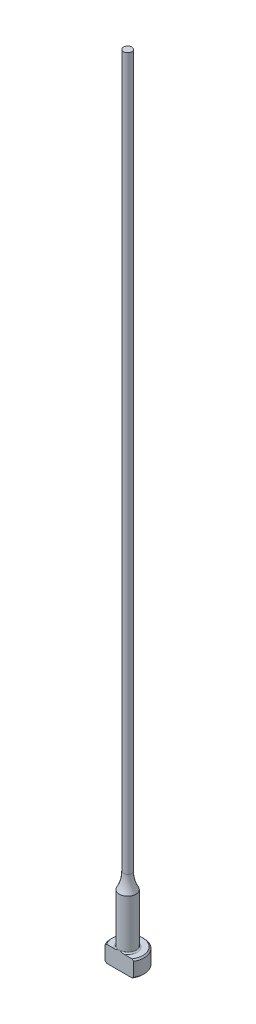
SolidWorks part; units mm, degrees
ref_plane "Front Plane" through (0, 0, 0) normal (0, 0, 1) x (1, 0, 0)
ref_plane "Top Plane" through (0, 0, 0) normal (0, 1, 0) x (1, 0, 0)
ref_plane "Right Plane" through (0, 0, 0) normal (1, 0, 0) x (0, 0, -1)
sketch "Sketch1" plane through (0, 0, 0) normal (0, 0, 1) x (1, 0, 0)
  line L0 (0, 259.9588) -> (0, -15.1925) construction
  line L1 (0, 0) -> (-3.175, 0)
  line L2 (-3.175, 0) -> (-3.175, 3.175)
  line L3 (-3.175, 3.175) -> (-1.5875, 3.175)
  line L4 (-0.7937, 15.7742) -> (-0.7937, 152.4)
  line L5 (-0.7937, 152.4) -> (0, 152.4)
  line L6 (0, 152.4) -> (0, 0)
  line L7 (-1.5875, 3.175) -> (-1.5875, 12.7)
  arc A0 (-1.5875, 12.7) -> (-0.7937, 15.7742) centre (-7.1437, 15.7742) ccw
  point P13 (-1.5875, 0)
  dimension "D1" = 6.35
  dimension "L" = 152.4
  dimension "D2" = 3.175
  dimension "H" = 6.35
  dimension "T" = 3.175
  dimension "D" = 1.5875
  dimension "S" = 12.7
revolve "Revolve1" add sketch "Sketch1" angle 360 about L0
chamfer "Chamfer1" distance 0.254 angle 45 2 edges at (0, 3.175, 3.175) (0, 0, 3.175)
fillet "Fillet1" radius 0.254 1 edges at (0, 3.175, 1.5875)
sketch "Sketch2" plane through (0, 0, 0) normal (0, -1, 0) x (1, 0, 0)
  line L0 (-2.7496, 1.5875) -> (2.7496, 1.5875)
  circle A0 centre (0, 0) radius 3.175 construction
  arc A1 (2.7496, 1.5875) -> (-2.7496, 1.5875) centre (0, 0) ccw
  circle A4 centre (0, 0) radius 1.5875 construction
  dimension "D1" = 0
extrude "KEY" cut sketch "Sketch2" against normal through all
